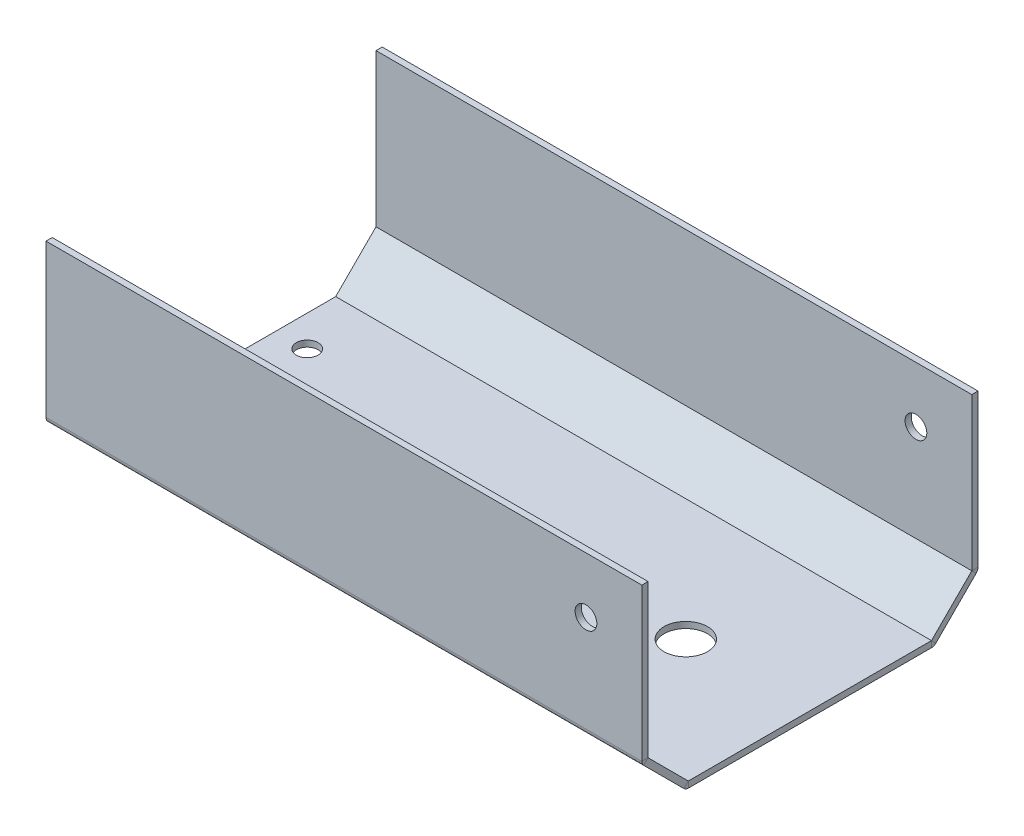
SolidWorks part; units mm, degrees
ref_plane "Front" through (0, 0, 0) normal (0, 0, 1) x (1, 0, 0)
ref_plane "Top" through (0, 0, 0) normal (0, 1, 0) x (1, 0, 0)
ref_plane "Right" through (0, 0, 0) normal (1, 0, 0) x (0, 0, -1)
sketch "Sketch1" plane through (0, 0, 0) normal (0, 1, 0) x (1, 0, 0)
  line L1 (0, 0) -> (96, 0)
  line L2 (0, 0) -> (0, 110)
  line L3 (0, 110) -> (96, 110)
  line L4 (96, 0) -> (96, 110)
  circle A1 centre (87, 101) radius 1.75
  circle A2 centre (87, 9) radius 1.75
  circle A4 centre (5, 65) radius 1.75
  circle A5 centre (5, 45) radius 1.75
  circle A6 centre (76, 55) radius 3.5
  dimension "D1" = 5
  dimension "D2" = 5
sheet metal parameters "Sheet-Metal1" thickness 1 parameters "D1"=0
base flange "Base-Flange1" sketch "Sketch1" thickness 1 reverse thickness direction yes parameters "D1"=0
sketch "Sketch3" plane through (0, 1, 0) normal (0, 1, 0) x (-1, 0, 0)
  line L2 (0, -85) -> (-96, -85)
  line L3 (0, -25) -> (-96, -25)
  line L4 (0, -75) -> (-96, -75)
  line L5 (0, -35) -> (-96, -35)
sketched bend "Sketched Bend1" parameters "D1"=0
bend "SketchBend1" bend radius 0 bend angle 45 parameters "D5"=1
bend "SketchBend2" bend radius 0 bend angle 45 parameters "D5"=2
bend "SketchBend3" bend radius 0 bend angle 45 parameters "D5"=3
bend "SketchBend4" bend radius 0 bend angle 45 parameters "D5"=4
flat pattern "Flat-Pattern1"
sketch "Bend-Lines1" plane through (0, 1, 0) normal (0, 1, 0) x (-1, 0, 0)
  line L0 (-96, -35) -> (0, -35) construction
  line L1 (0, -75) -> (-96, -75) construction
  line L2 (-96, -25) -> (0, -25) construction
  line L3 (0, -85) -> (-96, -85) construction
bend of the flat pattern "Flatten-<SketchBend1>1"
bend of the flat pattern "Flatten-<SketchBend2>1"
bend of the flat pattern "Flatten-<SketchBend3>1"
bend of the flat pattern "Flatten-<SketchBend4>1"
